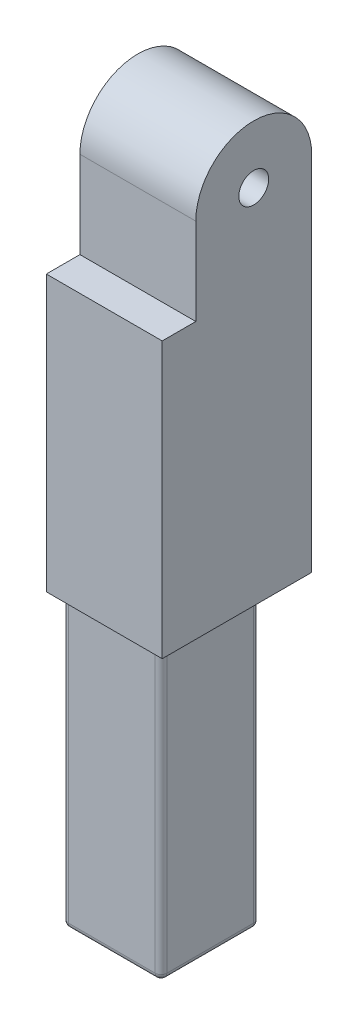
SolidWorks part; units mm, degrees
ref_plane "Front" through (0, 0, 0) normal (0, 0, 1) x (1, 0, 0)
ref_plane "Top" through (0, 0, 0) normal (0, 1, 0) x (1, 0, 0)
ref_plane "Right" through (0, 0, 0) normal (1, 0, 0) x (0, 0, -1)
sketch "Sketch1" plane through (0, 0, 0) normal (1, 0, 0) x (0, 0, -1)
  line L2 (25.4, 0) -> (25.4, -152.4)
  line L3 (25.4, -152.4) -> (-25.4, -152.4)
  line L4 (-25.4, 0) -> (-25.4, -152.4)
  circle A0 centre (0, 0) radius 6.5481
  arc A1 (25.4, 0) -> (-25.4, 0) centre (0, 0) ccw
  dimension "D1" = 13.0962
  dimension "D2" = 50.8
  dimension "D3" = 152.4
extrude "Extrude1" add sketch "Sketch1" along normal blind 101.6
sketch "Sketch2" plane through (0, -152.4, 0) normal (0, -1, 0) x (1, 0, 0)
  line L0 (101.6, 0) -> (0, 0) construction
  line L1 (101.6, 25.4) -> (101.6, -25.4) construction
  line L2 (50.8, -25.4) -> (50.8, 25.4) construction
  line L3 (101.6, -25.4) -> (0, -25.4) construction
  line L4 (101.6, 25.4) -> (0, 25.4) construction
  line L6 (3.81, 21.59) -> (46.99, 21.59)
  line L7 (3.81, 21.59) -> (3.81, -21.59)
  line L8 (3.81, -21.59) -> (46.99, -21.59)
  line L9 (46.99, 21.59) -> (46.99, -21.59)
  line L10 (-16.5907, 48.6147) -> (110.6996, 48.6147)
  line L11 (-16.5907, 48.6147) -> (-16.5907, -43.0907)
  line L12 (-16.5907, -43.0907) -> (110.6996, -43.0907)
  line L13 (110.6996, 48.6147) -> (110.6996, -43.0907)
  line L14 (0, 25.4) -> (0, -25.4) construction
  dimension "D1" = 43.18
  dimension "D2" = 43.18
  dimension "D3" = 21.59
  dimension "D4" = 3.81
extrude "Cut-Extrude1" cut sketch "Sketch2" against normal blind 50.8
sketch "Sketch3" plane through (0, 0, 25.4) normal (0, 0, 1) x (1, 0, 0)
  line L0 (25.4, -101.6) -> (25.4, 44.3372) construction
  line L1 (46.99, -101.6) -> (3.81, -101.6) construction
  line L2 (101.6, 25.4) -> (0, 25.4) construction
  line L3 (72.0863, 35.6917) -> (107.9034, 35.6917)
  line L4 (0, 0) -> (0, -101.6) construction
  line L5 (55.5159, -88.9) -> (107.9034, -88.9)
  line L6 (107.9034, 35.6917) -> (107.9034, -88.9)
  line L8 (72.0863, 35.6917) -> (50.8, 35.6917)
  line L10 (55.5159, -88.9) -> (50.8, -88.9)
  line L11 (50.8, 35.6917) -> (50.8, -88.9)
  dimension "D1" = 114.3
  dimension "D2" = 50.8
  dimension "D3" = 52.3875
extrude "Cut-Extrude2" cut sketch "Sketch3" against normal through all
chamfer "Chamfer1" distance 1.5875 angle 45 4 edges at (25.4, -152.4, 21.59) (46.99, -152.4, 0) (25.4, -152.4, -21.59) (3.81, -152.4, 0)
sketch "Sketch7" plane through (50.8, 0, 0) normal (1, 0, 0) x (0, 0, -1)
  line L1 (40.5891, -78.9915) -> (-40.7734, -78.9915)
  line L2 (40.5891, -78.9915) -> (40.5891, -104.5033)
  line L3 (40.5891, -104.5033) -> (-40.7734, -104.5033)
  line L4 (-40.7734, -78.9915) -> (-40.7734, -104.5033)
extrude "Cut-Extrude6" cut sketch "Sketch7" along normal through all
sketch "Sketch8" plane through (50.8, 0, 0) normal (1, 0, 0) x (0, 0, -1)
  line L0 (25.4, 0) -> (25.4, -101.6) construction
  line L1 (25.4, -38.1) -> (-101.6, -38.1)
  line L2 (25.4, -38.1) -> (25.4, -88.9)
  line L3 (25.4, -88.9) -> (-101.6, -88.9)
  line L4 (-101.6, -38.1) -> (-101.6, -88.9)
  line L5 (-25.4, 0) -> (-25.4, -101.6) construction
  circle A1 centre (0, 0) radius 6.5481 construction
  dimension "D2" = 38.1
  dimension "D1" = 50.8
  dimension "D3" = 76.2
extrude "Extrude2" add sketch "Sketch8" against normal up to surface (50.8 mm away)
sketch "Sketch9" plane through (0, 0, 101.6) normal (0, 0, 1) x (1, 0, 0)
  line L0 (50.8, -63.5) -> (0, -63.5) construction
  line L1 (50.8, -38.1) -> (50.8, -88.9) construction
  line L2 (0, -88.9) -> (0, -38.1) construction
  line L3 (25.4, -38.1) -> (25.4, -88.9) construction
  line L4 (0, -38.1) -> (50.8, -38.1) construction
  line L5 (0, -88.9) -> (50.8, -88.9) construction
  line L7 (3.81, -41.91) -> (46.99, -41.91)
  line L8 (3.81, -41.91) -> (3.81, -85.09)
  line L9 (3.81, -85.09) -> (46.99, -85.09)
  line L10 (46.99, -41.91) -> (46.99, -85.09)
  line L11 (-26.7597, -23.7395) -> (84.6251, -23.7395)
  line L12 (-26.7597, -23.7395) -> (-26.7597, -109.3562)
  line L13 (-26.7597, -109.3562) -> (84.6251, -109.3562)
  line L14 (84.6251, -23.7395) -> (84.6251, -109.3562)
  dimension "D1" = 43.18
  dimension "D2" = 21.59
  dimension "D3" = 43.18
  dimension "D4" = 21.59
extrude "Cut-Extrude7" cut sketch "Sketch9" against normal blind 50.8
sketch "Sketch10" plane through (0, -88.9, 0) normal (0, -1, 0) x (1, 0, 0)
  line L1 (-7.8409, -42.2764) -> (57.7035, -42.2764)
  line L2 (-7.8409, -42.2764) -> (-7.8409, 29.7371)
  line L3 (-7.8409, 29.7371) -> (57.7035, 29.7371)
  line L4 (57.7035, -42.2764) -> (57.7035, 29.7371)
extrude "Cut-Extrude8" cut sketch "Sketch10" along normal through all
chamfer "Chamfer2" distance 1.5875 angle 45 4 edges at (46.99, -63.5, 101.6) (25.4, -85.09, 101.6) (3.81, -63.5, 101.6) (25.4, -41.91, 101.6)
sketch "Sketch11" plane through (0, 0, 25.4) normal (0, 0, 1) x (1, 0, 0)
  line L1 (57.8458, -32.683) -> (-5.5213, -32.683)
  line L2 (57.8458, -32.683) -> (57.8458, -91.417)
  line L3 (57.8458, -91.417) -> (-5.5213, -91.417)
  line L4 (-5.5213, -32.683) -> (-5.5213, -91.417)
extrude "Cut-Extrude9" cut sketch "Sketch11" along normal through all
sketch "Sketch12" plane through (0, -88.9, 0) normal (0, -1, 0) x (1, 0, 0)
  line L1 (50.8, -25.4) -> (0, -25.4)
  line L2 (50.8, -25.4) -> (50.8, 25.4)
  line L3 (50.8, 25.4) -> (0, 25.4)
  line L4 (0, -25.4) -> (0, 25.4)
extrude "Extrude3" add sketch "Sketch12" along normal blind 19.05
sketch "Sketch13" plane through (0, 0, 25.4) normal (0, 0, 1) x (1, 0, 0)
  line L0 (50.8, 0) -> (50.8, -107.95) construction
  line L1 (0, -107.95) -> (50.8, -107.95)
  line L2 (0, -107.95) -> (0, -38.1)
  line L3 (0, -38.1) -> (50.8, -38.1)
  line L4 (50.8, -107.95) -> (50.8, -38.1)
  dimension "D1" = 69.85
extrude "Extrude4" add sketch "Sketch13" along normal blind 14.732
sketch "Sketch14" plane through (0, -107.95, 0) normal (0, -1, 0) x (1, 0, 0)
  line L1 (0, -25.4) -> (50.8, -25.4)
  line L2 (0, -25.4) -> (0, 40.132)
  line L3 (0, 40.132) -> (50.8, 40.132)
  line L4 (50.8, -25.4) -> (50.8, 40.132)
extrude "Extrude5" add sketch "Sketch14" along normal blind 50.8
sketch "Sketch15" plane through (0, -158.75, 0) normal (0, -1, 0) x (1, 0, 0)
  line L0 (50.8, 40.132) -> (0, 40.132) construction
  line L1 (3.556, 36.576) -> (46.736, 36.576)
  line L2 (3.556, 36.576) -> (3.556, -6.604)
  line L3 (3.556, -6.604) -> (46.736, -6.604)
  line L4 (46.736, 36.576) -> (46.736, -6.604)
  line L5 (0, 40.132) -> (0, -25.4) construction
  dimension "D1" = 43.18
  dimension "D2" = 43.18
  dimension "D3" = 3.556
  dimension "D4" = 3.556
extrude "Extrude6" add sketch "Sketch15" along normal blind 127
fillet "Fillet1" radius 2.54 8 edges at (25.146, -285.75, 36.576) (46.736, -285.75, 14.986) (25.146, -285.75, -6.604) (3.556, -285.75, 14.986) (3.556, -222.25, 36.576) (3.556, -222.25, -6.604) (46.736, -222.25, -6.604) (46.736, -222.25, 36.576)
